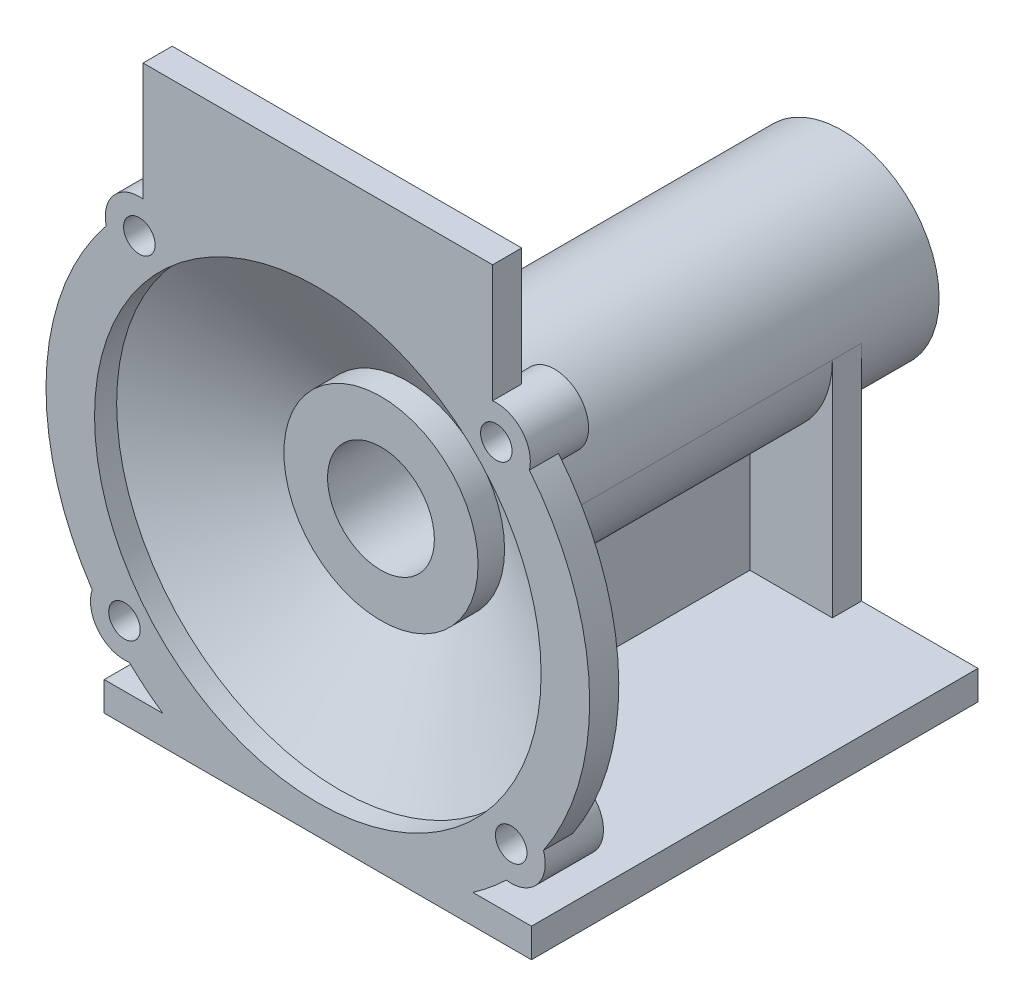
SolidWorks part; units mm, degrees
ref_plane "Front" through (0, 0, 0) normal (0, 0, 1) x (1, 0, 0)
ref_plane "Top" through (0, 0, 0) normal (0, 1, 0) x (1, 0, 0)
ref_plane "Right" through (0, 0, 0) normal (1, 0, 0) x (0, 0, -1)
sketch "Sketch1" plane through (0, 0, 0) normal (1, 0, 0) x (0, 0, -1)
  line L0 (0, 0) -> (89.8884, 0) construction
  line L1 (0, -73.025) -> (0, -88.9)
  line L2 (0, -88.9) -> (9.525, -88.9)
  line L3 (9.525, -88.9) -> (40.1411, -31.75)
  line L4 (40.1411, -31.75) -> (171.45, -31.75)
  line L5 (171.45, -31.75) -> (171.45, -17.4625)
  line L6 (171.45, -17.4625) -> (120.65, -17.4625)
  line L7 (120.65, -17.4625) -> (120.65, -20.6375)
  line L8 (120.65, -20.6375) -> (69.85, -20.6375)
  line L9 (69.85, -20.6375) -> (69.85, -17.4625)
  line L10 (69.85, -17.4625) -> (20.6502, -17.4625)
  line L11 (20.6502, -17.4625) -> (20.6502, -31.75)
  line L12 (20.6502, -31.75) -> (29.3354, -31.75)
  line L13 (29.3354, -31.75) -> (7.2238, -73.025)
  line L14 (7.2238, -73.025) -> (0, -73.025)
  point P5 (57.15, 0)
  dimension "D1" = 34.925
  dimension "D2" = 41.275
  dimension "D3" = 50.8
  dimension "D4" = 50.8
  dimension "D5" = 63.5
  dimension "D6" = 146.05
  dimension "D7" = 177.8
  dimension "D8" = 9.525
  dimension "D9" = 9.525
  dimension "D10" = 20.6502
  dimension "D11" = 171.45
  dimension "D12" = 57.15
revolve "Revolve1" add sketch "Sketch1" angle 360 about L0
sketch "Sketch2" plane through (0, 0, 0) normal (0, 0, 1) x (1, 0, 0)
  line L0 (0, 0) -> (0, 144.1236) construction
  line L1 (-57.15, 68.0962) -> (-26.3735, 68.0962)
  line L2 (-57.15, 68.0962) -> (-57.15, 107.95)
  line L3 (-57.15, 107.95) -> (57.15, 107.95)
  line L4 (57.15, 68.0962) -> (57.15, 107.95)
  line L5 (26.3735, 68.0962) -> (57.15, 68.0962)
  circle A0 centre (0, 0) radius 88.9 construction
  circle A1 centre (0, 0) radius 73.025 construction
  arc A2 (26.3735, 68.0962) -> (-26.3735, 68.0962) centre (0, 0) ccw
  dimension "D1" = 114.3
  dimension "D2" = 107.95
extrude "Extrude1" add sketch "Sketch2" against normal blind 9.525
sketch "Sketch3" plane through (0, 0, 0) normal (0, 0, 1) x (1, 0, 0)
  line L0 (0, 0) -> (105.8426, 0) construction
  line L1 (0, 0) -> (73.9921, 73.9921) construction
  line L2 (49.9927, 65.6904) -> (43.7106, 58.4982)
  line L3 (65.6904, 49.9927) -> (58.4982, 43.7106)
  circle A0 centre (0, 0) radius 82.55 construction
  arc A1 (49.9927, 65.6904) -> (65.6904, 49.9927) centre (58.3717, 58.3717) cw
  circle A2 centre (0, 0) radius 73.025 construction
  circle A3 centre (0, 0) radius 73.025 construction
  arc A4 (58.4982, 43.7106) -> (43.7106, 58.4982) centre (0, 0) ccw
  dimension "D2" = 165.1
  dimension "D3" = 11.1252
  dimension "D1" = 45
extrude "Extrude2" add sketch "Sketch3" against normal blind 19.05
sketch "Sketch4" plane through (0, 0, -19.05) normal (0, 0, -1) x (-1, 0, 0)
  circle A0 centre (-58.3717, 58.3717) radius 5.1562
  dimension "D1" = 10.3124
extrude "Extrude3" cut sketch "Sketch4" against normal through all
pattern_circular "CirPattern1" count 2 every 85 about axis through (0, 0, 0) along (0, 0, 1) of "Extrude2", "Extrude3"
mirror "Mirror1" about plane through (0, 0, 0) normal (1, 0, 0) of "CirPattern1", "Extrude2", "Extrude3"
other "DeleteFace1"
ref_plane "Plane1" through (0, -82.55, 0) normal (0, 1, 0) x (-1, 0, 0)
other "SurfaceCut1"
sketch "Sketch5" plane through (0, -82.55, 0) normal (0, 1, 0) x (-1, 0, 0)
  line L0 (0, -146.05) -> (0, 0) construction
  line L1 (-69.85, 0) -> (69.85, 0)
  line L2 (-69.85, 0) -> (-69.85, -146.05)
  line L3 (-69.85, -146.05) -> (69.85, -146.05)
  line L4 (69.85, 0) -> (69.85, -146.05)
  dimension "D1" = 139.7
  dimension "D2" = 146.05
extrude "Extrude4" add sketch "Sketch5" along normal blind 9.525
sketch "Sketch8" plane through (0, 0, -146.05) normal (0, 0, -1) x (-1, 0, 0)
  line L0 (0, -73.025) -> (0, -31.75)
  line L1 (-69.85, -73.025) -> (69.85, -73.025) construction
  circle A0 centre (0, 0) radius 31.75 construction
rib "Rib2" sketch "Sketch8" sketch "Sketch8" thickness 9.525 extrusion direction normal to sketch draft on no parameters "D1"=9.525
sketch "Sketch9" plane through (0, 0, -146.05) normal (0, 0, -1) x (-1, 0, 0)
  line L0 (-31.75, 0) -> (-31.75, -73.025)
  line L4 (-4.7625, -73.025) -> (-50.7007, -73.025) construction
  line L6 (31.75, 0) -> (31.75, -73.025)
  line L7 (50.7007, -73.025) -> (4.7625, -73.025) construction
  line L8 (-31.75, -73.025) -> (31.75, -73.025)
  arc A4 (4.7625, -31.3908) -> (-4.7625, -31.3908) centre (0, 0) ccw construction
  circle A5 centre (0, 0) radius 31.75 construction
  arc A6 (-31.75, 0) -> (31.75, 0) centre (0, 0) ccw
extrude "Extrude5" add sketch "Sketch9" against normal blind 9.525
sketch "Sketch10" plane through (0, 0, 0) normal (1, 0, 0) x (0, 0, -1)
  line L0 (0, -49.5673) -> (0, -64.1873) construction
  line L1 (0, -82.55) -> (146.05, -82.55) construction
  circle A0 centre (63.5, -53.975) radius 12.7
  dimension "D1" = 25.4
  dimension "D2" = 63.5
  dimension "D3" = 28.575
extrude "Extrude6" cut sketch "Sketch10" against normal through all and the other way through all
